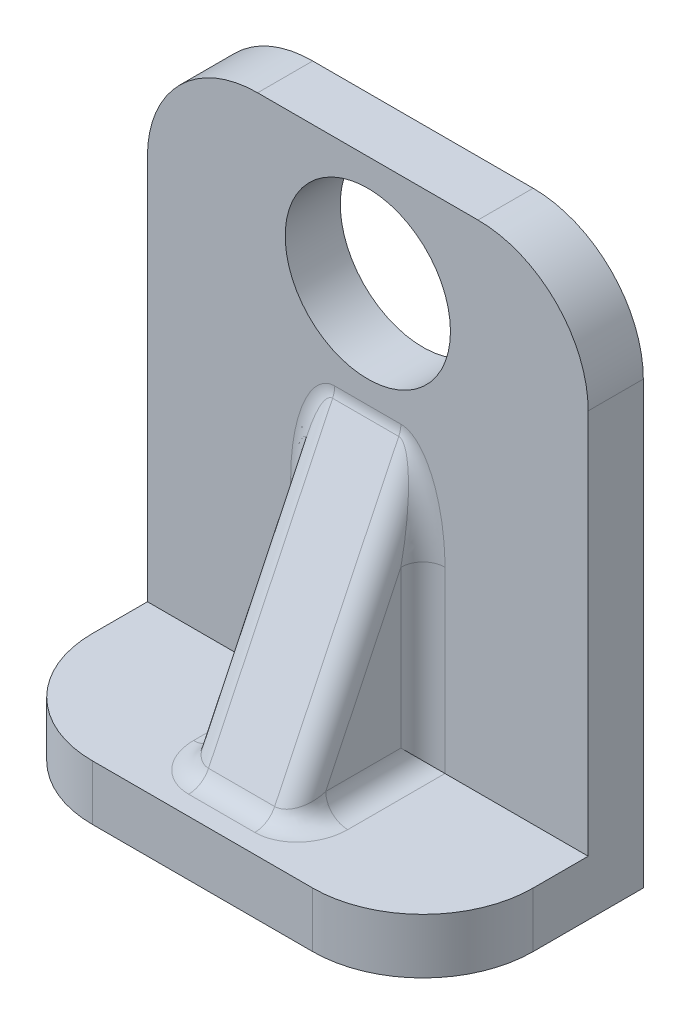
SolidWorks part; units mm, degrees
ref_plane "Front Plane" through (0, 0, 0) normal (0, 0, 1) x (1, 0, 0)
ref_plane "Top Plane" through (0, 0, 0) normal (0, 1, 0) x (1, 0, 0)
ref_plane "Right Plane" through (0, 0, 0) normal (1, 0, 0) x (0, 0, -1)
sketch "Sketch1" plane through (0, 0, 0) normal (1, 0, 0) x (0, 0, -1)
  line L0 (0, 0) -> (20, 0)
  line L1 (20, 0) -> (20, 50)
  line L2 (20, 50) -> (15, 50)
  line L3 (15, 50) -> (15, 5)
  line L4 (15, 5) -> (0, 5)
  line L5 (0, 5) -> (0, 0)
  dimension "D1" = 20
  dimension "D2" = 50
  dimension "D3" = 5
  dimension "D4" = 5
extrude "Boss-Extrude1" add sketch "Sketch1" along normal mid plane 40
fillet "Fillet1" radius 10 4 edges at (20, 2.5, 0) (-20, 2.5, 0) (-20, 50, -17.5) (20, 50, -17.5)
sketch "Sketch2" plane through (0, 0, 0) normal (1, 0, 0) x (0, 0, -1)
  line L0 (3, 5) -> (15, 30)
  line L1 (10, 5) -> (0, 5) construction
  line L2 (15, 40) -> (15, 5) construction
  point P9 (17.5568, 20.4811)
  dimension "D1" = 3
  dimension "D2" = 30
rib "Rib1" sketch "Sketch2" sketch "Sketch2" thickness 10 extrusion direction parallel to sketch draft on no parameters "D1"=10
fillet "Fillet2" radius 2 8 edges at (5, 5, -9) (5, 17.5, -15) (5, 17.5, -9) (0, 5, -3) (-5, 17.5, -9) (0, 30, -15) (-5, 17.5, -15) (-5, 5, -9)
sketch "Sketch3" plane through (0, 0, -15) normal (0, 0, 1) x (1, 0, 0)
  circle A0 centre (0, 40) radius 7.5
  dimension "D1" = 15
  dimension "D2" = 40
extrude "Cut-Extrude1" cut sketch "Sketch3" against normal up to next
